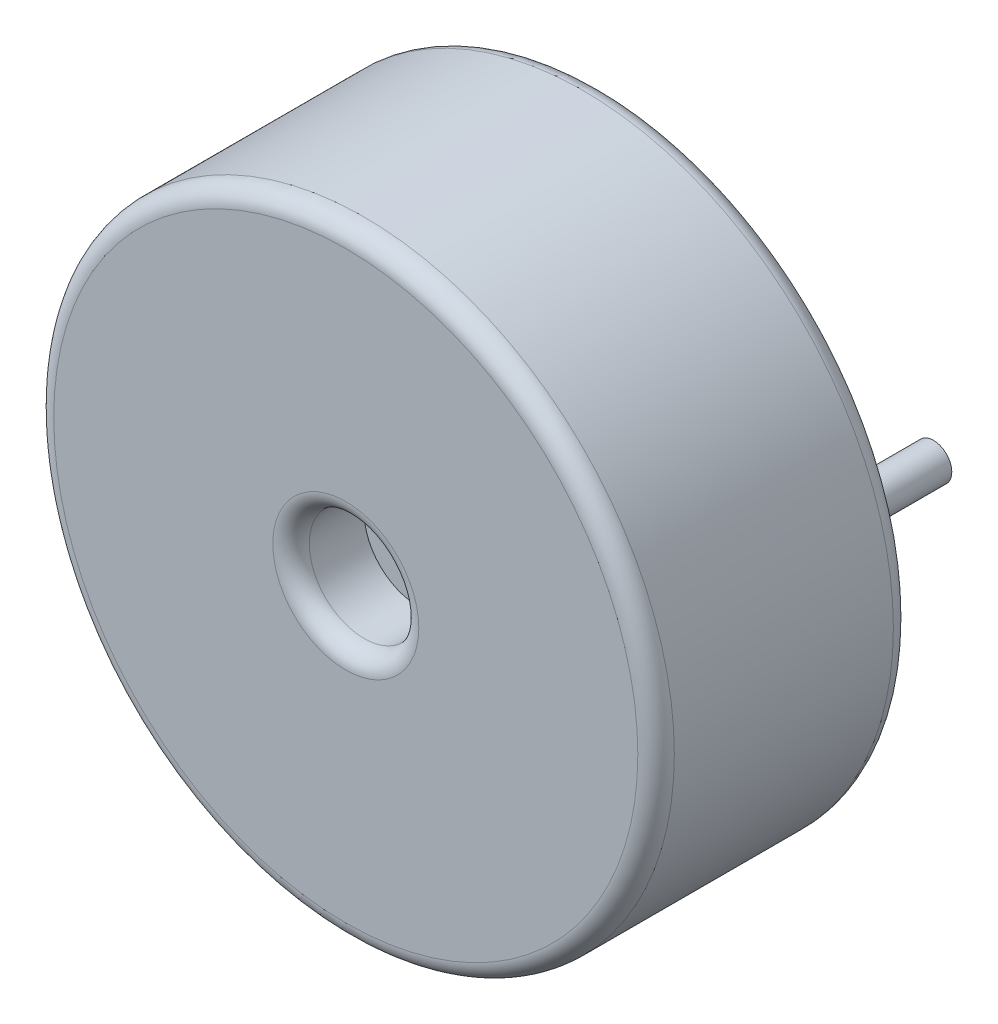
SolidWorks part; units mm, degrees
ref_plane "Face" through (0, 0, 0) normal (0, 0, 1) x (1, 0, 0)
ref_plane "Dessus" through (0, 0, 0) normal (0, 1, 0) x (1, 0, 0)
ref_plane "Droite" through (0, 0, 0) normal (1, 0, 0) x (0, 0, -1)
sketch "Esquisse1" plane through (0, 0, 0) normal (0, 0, 1) x (1, 0, 0)
  circle A0 centre (0, 0) radius 8.5
  dimension "D1" = 17
extrude "Extrusion1" add sketch "Esquisse1" along normal blind 7
sketch "Esquisse2" plane through (0, 0, 7) normal (0, 0, 1) x (1, 0, 0)
  circle A0 centre (0, 0) radius 1.5
  circle A1 centre (0, 0) radius 8.5 construction
  dimension "D1" = 3
extrude "Enlèv. mat.-Extru.1" cut sketch "Esquisse2" against normal blind 2
sketch "Esquisse3" plane through (0, 0, 0) normal (0, 0, -1) x (-1, 0, 0)
  line L0 (-8.5, 0) -> (8.5, 0) construction
  line L1 (0, 8.5) -> (0, -8.5) construction
  circle A0 centre (0, 0) radius 8.5 construction
  circle A1 centre (-5.1, 0) radius 0.5
  circle A2 centre (5.1, 0) radius 0.5
  dimension "D1" = 1
  dimension "D2" = 10.2
extrude "Extrusion2" add sketch "Esquisse3" along normal blind 4
fillet "Congé1" radius 0.5 3 edges at (8.5, 0, 0) (8.5, 0, 7) (1.5, 0, 7)
